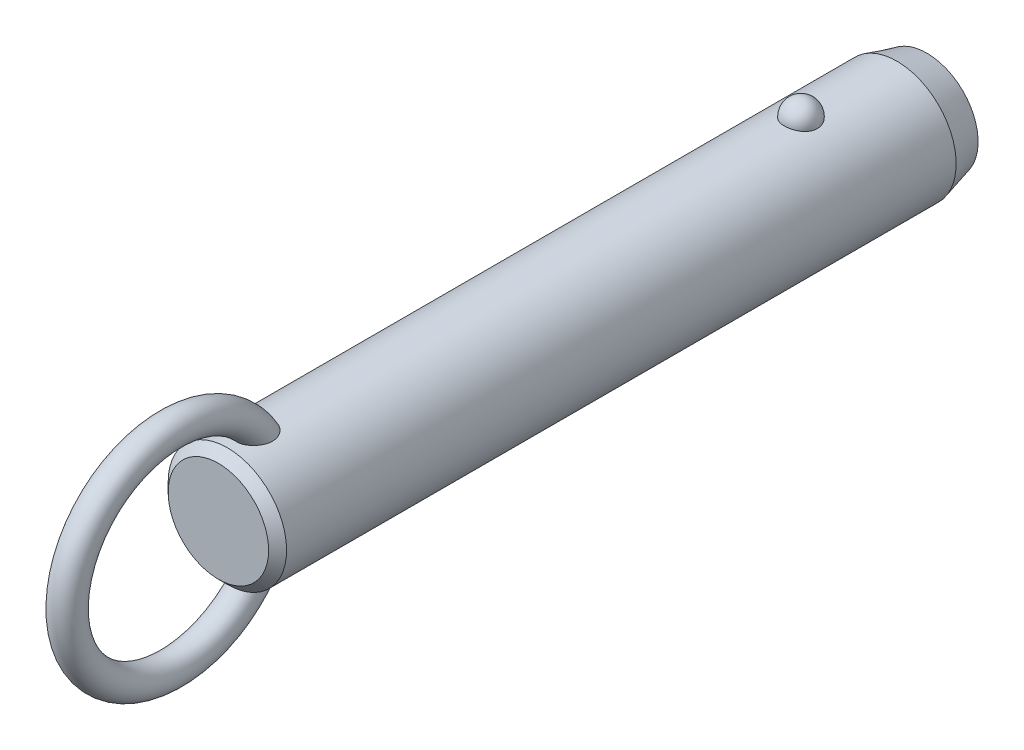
SolidWorks part; units mm, degrees
ref_plane "Front Plane" through (0, 0, 0) normal (0, 0, 1) x (1, 0, 0)
ref_plane "Top Plane" through (0, 0, 0) normal (0, 1, 0) x (1, 0, 0)
ref_plane "Right Plane" through (0, 0, 0) normal (1, 0, 0) x (0, 0, -1)
sketch "Sketch2" plane through (0, 0, 0) normal (0, 0, 1) x (1, 0, 0)
  circle A0 centre (0, 0) radius 7.9
  point P3 (0, 7.9)
  dimension "D1" = 15.8
extrude "Boss-Extrude1" add sketch "Sketch2" along normal blind 66
sketch "Sketch3" plane through (0, 0, 0) normal (0, 0, -1) x (-1, 0, 0)
  circle A0 centre (0, 0) radius 7.9
  dimension "D1" = 15.8
extrude "Boss-Extrude2" add sketch "Sketch3" along normal blind 19
chamfer "Chamfer1" distance 4 angle 15 1 edges at (-7.9, 0, -19)
sketch "Sketch12" plane through (0, 0, 0) normal (1, 0, 0) x (0, 0, -1)
  line L0 (-66, 7.9) -> (-66, -7.9) construction
  point P0 (-66, 0)
sketch "Sketch13" plane through (0, 0, 0) normal (1, 0, 0) x (0, 0, -1)
  circle A0 centre (-81.85, 0) radius 15.85
  point P2 (-66, 0)
  dimension "D1" = 31.7
sketch "Sketch14" plane through (0, 0, 0) normal (0, 1, 0) x (1, 0, 0)
  circle A0 centre (0, -68) radius 2
  point P2 (0, -66)
  dimension "D1" = 4
sweep "Sweep1" add profiles "Sketch14" path "Sketch13"
sketch "Sketch15" plane through (0, 0, 66) normal (0, 0, 1) x (1, 0, 0)
  circle A0 centre (0, 0) radius 7.9
  dimension "D1" = 15.8
extrude "Boss-Extrude3" add sketch "Sketch15" along normal blind 9.52
chamfer "Chamfer2" distance 1.2 angle 45 1 edges at (7.9, 0, 75.52)
sketch "Sketch18" plane through (0, 0, 0) normal (1, 0, 0) x (0, 0, -1)
  line L0 (15, 7.9) -> (-68.1091, 7.9) construction
  line L1 (2.2, 10.1) -> (2.2, 5.7)
  line L2 (-68.1091, -7.9) -> (15, -7.9) construction
  arc A0 (2.2, 10.1) -> (2.2, 5.7) centre (2.2, 7.9) ccw
  point P4 (0, 7.9)
  dimension "D1" = 18
revolve "Revolve1" add sketch "Sketch18" angle 360 about L1
